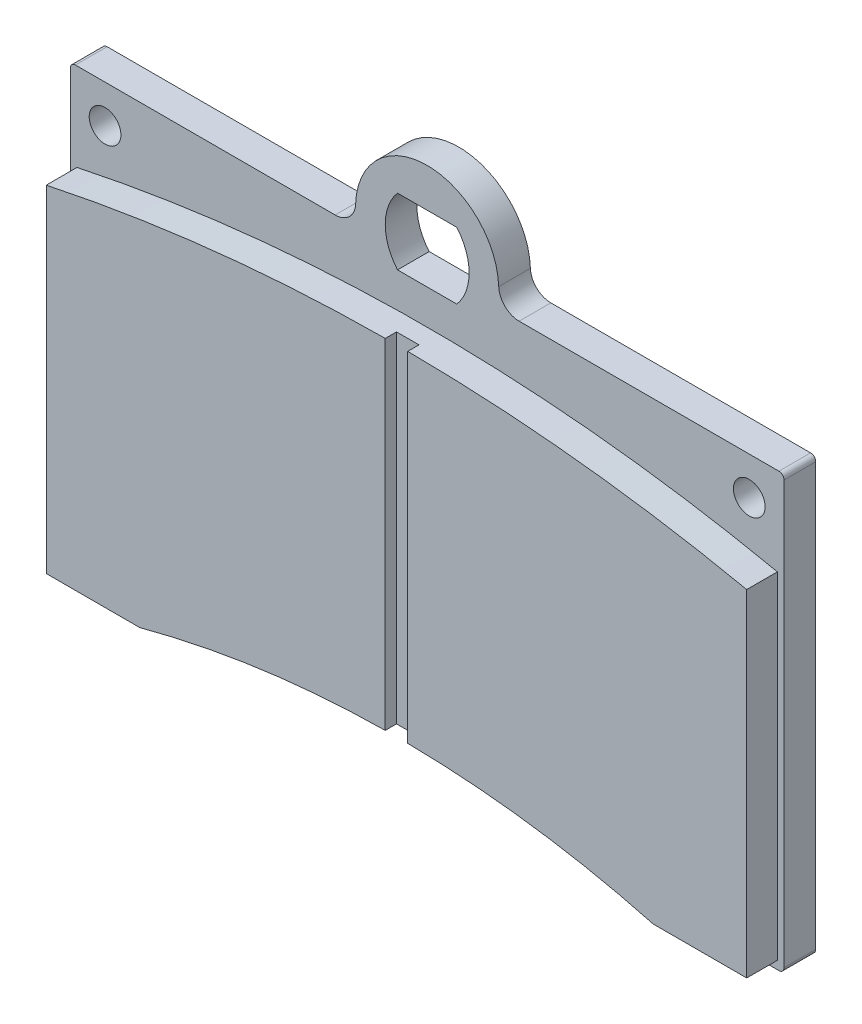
SolidWorks part; units mm, degrees
ref_plane "正面" through (0, 0, 0) normal (0, 0, 1) x (1, 0, 0)
ref_plane "平面" through (0, 0, 0) normal (0, 1, 0) x (1, 0, 0)
ref_plane "右側面" through (0, 0, 0) normal (1, 0, 0) x (0, 0, -1)
sketch "ｽｹｯﾁ1" plane through (0, 0, 0) normal (0, 0, 1) x (1, 0, 0)
  line L1 (0, 0) -> (69.8, 0)
  line L2 (0, 0) -> (0, 42.3)
  line L3 (0, 42.3) -> (69.8, 42.3)
  line L4 (69.8, 0) -> (69.8, 42.3)
  dimension "D1" = 69.8
  dimension "D2" = 42.3
extrude "ﾎﾞｽ - 押し出し1" add sketch "ｽｹｯﾁ1" along normal blind 3.1
sketch "ｽｹｯﾁ3" plane through (0, 0, 3.1) normal (0, 0, 1) x (1, 0, 0)
  line L0 (0, 0) -> (69.8, 0) construction
  line L1 (34.9, -93.047) -> (34.9, 0) construction
  line L2 (9.9, 0) -> (59.9, 0)
  line L3 (34.9, 3.3) -> (43.0311, 3.3) construction
  line L4 (69.8, 42.3) -> (0, 42.3) construction
  arc A0 (9.9, 0) -> (59.9, 0) centre (34.9, -93.047) cw
  dimension "D2" = 39
  dimension "D1" = 50
extrude "ｶｯﾄ - 押し出し1" cut sketch "ｽｹｯﾁ3" against normal through all
sketch "ｽｹｯﾁ2" plane through (0, 0, 3.1) normal (0, 0, 1) x (1, 0, 0)
  line L0 (0.65, 33.7) -> (0.65, 0.8)
  line L1 (0.65, 0.8) -> (9.7946, 0.8)
  line L2 (34.9, 0) -> (34.9, 42.3) construction
  line L3 (0, 0) -> (9.9, 0) construction
  line L4 (69.15, 33.7) -> (69.15, 0.8)
  line L5 (69.15, 0.8) -> (60.0054, 0.8)
  line L6 (34.9, 4.1) -> (48.2007, 4.1) construction
  line L7 (69.8, 42.3) -> (0, 42.3) construction
  line L8 (34.9, 37.3) -> (20.4997, 37.3) construction
  arc A0 (9.7946, 0.8) -> (60.0054, 0.8) centre (34.9, -93.047) cw
  arc A1 (69.15, 33.7) -> (0.65, 33.7) centre (34.9, -127.4253) ccw
  arc A2 (59.9, 0) -> (9.9, 0) centre (34.9, -93.047) ccw construction
  dimension "D4" = 0.8
  dimension "D1" = 68.5
  dimension "D2" = 0.8
  dimension "D3" = 8.6
  dimension "D5" = 5
extrude "ﾎﾞｽ - 押し出し2" add sketch "ｽｹｯﾁ2" along normal blind 3
sketch "ｽｹｯﾁ4" plane through (0, 0, 6.1) normal (0, 0, 1) x (1, 0, 0)
  line L0 (34.9, 42.3) -> (34.9, 4.0938) construction
  line L1 (33.8, 37.3) -> (36, 37.3)
  line L2 (33.8, 37.3) -> (33.8, 4.0938)
  line L3 (33.8, 4.0938) -> (36, 4.0938)
  line L4 (36, 37.3) -> (36, 4.0938)
  line L5 (69.8, 42.3) -> (0, 42.3) construction
  arc A0 (69.15, 33.7) -> (0.65, 33.7) centre (34.9, -127.4253) ccw construction
  arc A1 (60.0054, 0.8) -> (9.7946, 0.8) centre (34.9, -93.047) ccw construction
  dimension "D1" = 2.2
extrude "ｶｯﾄ - 押し出し2" cut sketch "ｽｹｯﾁ4" against normal offset from surface (1.1 mm away) 5
sketch "ｽｹｯﾁ5" plane through (0, 0, 3.1) normal (0, 0, 1) x (1, 0, 0)
  line L0 (34.9, 42.3) -> (34.9, 44) construction
  line L1 (69.8, 42.3) -> (0, 42.3) construction
  line L2 (34.9, 44) -> (34.9, 51) construction
  circle A0 centre (34.9, 44) radius 7
  dimension "D1" = 14
  dimension "D2" = 8.7
extrude "ﾎﾞｽ - 押し出し3" add sketch "ｽｹｯﾁ5" against normal up to surface (3.1 mm away)
fillet "ﾌｨﾚｯﾄ1" radius 2 2 edges at (41.6904, 42.3, 1.55) (28.1096, 42.3, 1.55)
sketch "ｽｹｯﾁ6" plane through (0, 0, 3.1) normal (0, 0, 1) x (1, 0, 0)
  line L0 (34.9, 44) -> (34.9, 47.2) construction
  line L1 (32, 47.2) -> (37.8, 47.2)
  line L2 (32, 47.2) -> (32, 40.7) construction
  line L3 (32, 40.7) -> (37.8, 40.7)
  line L4 (37.8, 47.2) -> (37.8, 40.7) construction
  line L5 (25.905, 42.3) -> (0, 42.3) construction
  line L6 (30.8, 43.95) -> (39, 43.95) construction
  arc A0 (32, 40.7) -> (32, 47.2) centre (35.801, 43.95) cw
  arc A1 (37.8, 40.7) -> (37.8, 47.2) centre (33.999, 43.95) ccw
  dimension "D1" = 6.5
  dimension "D2" = 5.8
  dimension "D3" = 1.6
  dimension "D4" = 8.2
extrude "ｶｯﾄ - 押し出し3" cut sketch "ｽｹｯﾁ6" against normal through all
hole_wizard "Ø3.1 (3.1) 直径の穴1" positions "ｽｹｯﾁ7" profile "ｽｹｯﾁ8" hole size "Ø3.1" standard "JIS"
sketch "ｽｹｯﾁ7" plane through (0, 0, 3.1) normal (0, 0, 1) x (1, 0, 0)
  line L0 (34.9, 44) -> (34.9, 38.7446) construction
  line L2 (25.905, 42.3) -> (0, 42.3) construction
  point P0 (66.4, 38.6)
  point P2 (3.4, 38.6)
  dimension "D1" = 63
  dimension "D2" = 3.7
sketch "ｽｹｯﾁ8" plane through (66.4, 38.6, 3.1) normal (1, 0, 0) x (0, -1, 0)
  line L0 (0, 0) -> (0, 3.1)
  line L1 (0, 3.1) -> (1.55, 3.1)
  line L2 (1.55, 3.1) -> (1.55, 0)
  line L5 (1.55, 0) -> (0, 0)
  line L11 (0, -6.35) -> (0, 107.95) construction
  dimension "通し穴の直径" = 3.1
  dimension "通し穴の深さ" = 3.1
fillet "ﾌｨﾚｯﾄ2" radius 0.5 4 edges at (69.8, 42.3, 1.55) (69.8, 0, 1.55) (0, 0, 1.55) (0, 42.3, 1.55)
ref_plane "平面1" through (0, 43.95, 0) normal (0, 1, 0) x (-1, 0, 0)
ref_plane "平面2" through (34.9, 0, 0) normal (1, 0, 0) x (0, 0, -1)
